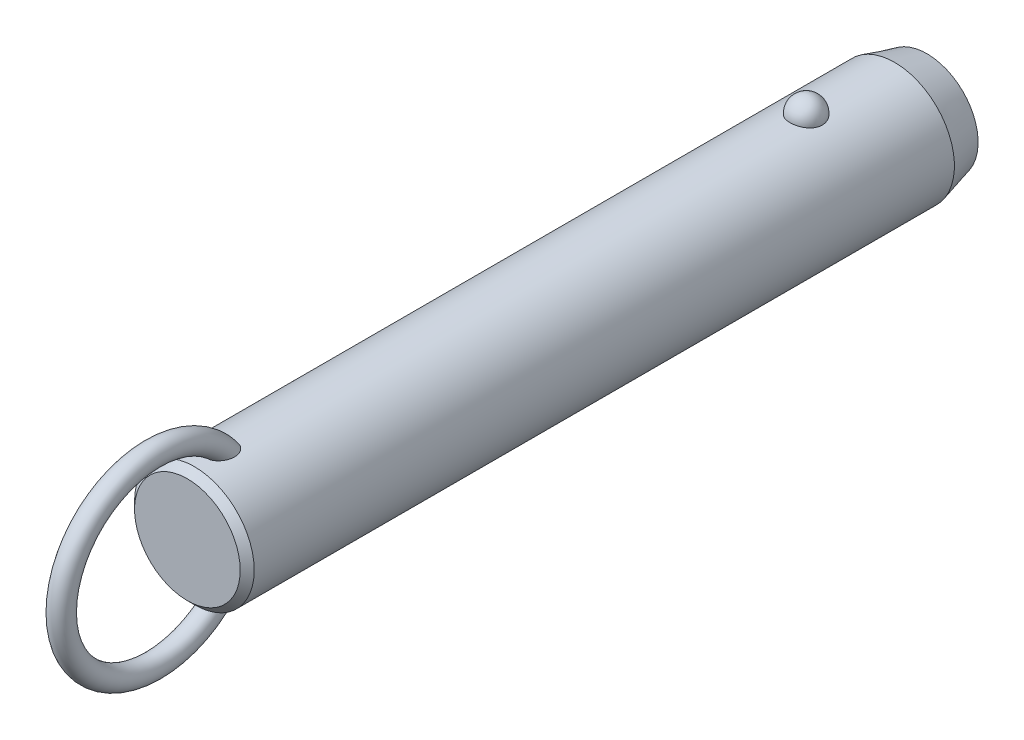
SolidWorks part; units mm, degrees
ref_plane "Front Plane" through (0, 0, 0) normal (0, 0, 1) x (1, 0, 0)
ref_plane "Top Plane" through (0, 0, 0) normal (0, 1, 0) x (1, 0, 0)
ref_plane "Right Plane" through (0, 0, 0) normal (1, 0, 0) x (0, 0, -1)
sketch "Sketch2" plane through (0, 0, 0) normal (0, 0, 1) x (1, 0, 0)
  circle A0 centre (0, 0) radius 11.1
  point P3 (0, 11.1)
  dimension "D1" = 22.2
extrude "Boss-Extrude1" add sketch "Sketch2" along normal blind 99.1
sketch "Sketch3" plane through (0, 0, 0) normal (0, 0, -1) x (-1, 0, 0)
  circle A0 centre (0, 0) radius 11.1
  dimension "D1" = 22.2
extrude "Boss-Extrude2" add sketch "Sketch3" along normal blind 25.4
chamfer "Chamfer1" distance 6 angle 15 1 edges at (-11.1, 0, -25.4)
sketch "Sketch12" plane through (0, 0, 0) normal (1, 0, 0) x (0, 0, -1)
  line L0 (-99.1, 11.1) -> (-99.1, -11.1) construction
  point P0 (-99.1, 0)
sketch "Sketch13" plane through (0, 0, 0) normal (1, 0, 0) x (0, 0, -1)
  circle A0 centre (-118.15, 0) radius 19.05
  point P2 (-99.1, 0)
  dimension "D1" = 38.1
sketch "Sketch14" plane through (0, 0, 0) normal (0, 1, 0) x (1, 0, 0)
  circle A0 centre (0, -101.1) radius 2
  point P2 (0, -99.1)
  dimension "D1" = 4
sweep "Sweep1" add profiles "Sketch14" path "Sketch13"
sketch "Sketch15" plane through (0, 0, 99.1) normal (0, 0, 1) x (1, 0, 0)
  circle A0 centre (0, 0) radius 11.1
  dimension "D1" = 22.2
extrude "Boss-Extrude3" add sketch "Sketch15" along normal blind 12.7
chamfer "Chamfer2" distance 1.3 angle 45 1 edges at (11.1, 0, 111.8)
sketch "Sketch18" plane through (0, 0, 0) normal (1, 0, 0) x (0, 0, -1)
  line L0 (19.4, 11.1) -> (-102.668, 11.1) construction
  line L1 (3, 14.1) -> (3, 8.1)
  line L2 (-102.668, -11.1) -> (19.4, -11.1) construction
  arc A0 (3, 14.1) -> (3, 8.1) centre (3, 11.1) ccw
  point P4 (0, 11.1)
  dimension "D1" = 25.2
revolve "Revolve1" add sketch "Sketch18" angle 360 about L1
